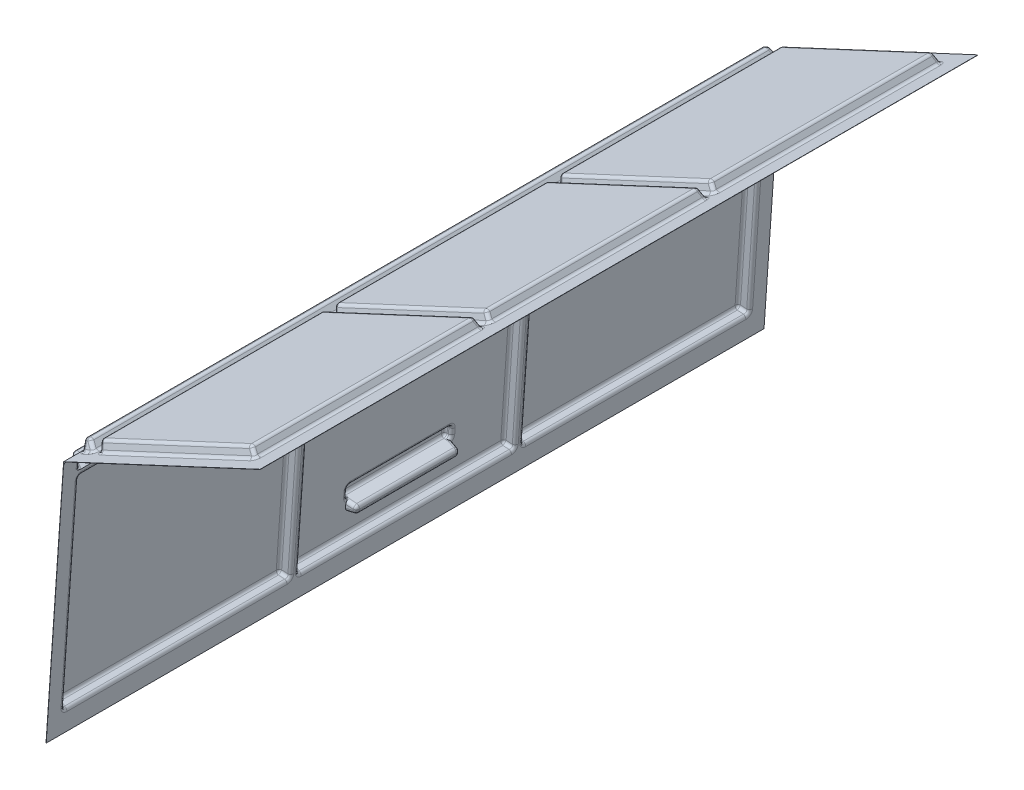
SolidWorks part; units mm, degrees
ref_plane "Plan de face" through (0, 0, 0) normal (0, 0, 1) x (1, 0, 0)
ref_plane "Plan de dessus" through (0, 0, 0) normal (0, 1, 0) x (1, 0, 0)
ref_plane "Plan de droite" through (0, 0, 0) normal (1, 0, 0) x (0, 0, -1)
sketch "Esquisse2" plane through (976.9196, -68.1059, 0) normal (-0.9976, 0.0695, 0) x (0, 0, 1)
  line L0 (-287.8758, 539.1032) -> (-287.8758, 154.1032) construction
  line L1 (-287.8758, 168.1032) -> (-1375.2758, 168.1032)
  line L2 (-287.8758, 168.1032) -> (-287.8758, 555.291)
  line L3 (-287.8758, 555.291) -> (-1375.2758, 555.291)
  line L4 (-1375.2758, 168.1032) -> (-1375.2758, 555.291)
  line L5 (-287.8758, 178.1032) -> (-1374.8758, 178.1032) construction
  line L6 (-291.0331, 555.291) -> (-304.0331, 555.291) construction
  line L7 (-1375.2758, 154.1032) -> (-1375.2758, 539.1032) construction
  dimension "D1" = 10
extrude "Boss.-Extru.1" add sketch "Esquisse2" along normal blind 0.25
sketch "Esquisse4" plane through (-3.1269, 6.702, 0) normal (-0.4228, 0.9062, 0) x (0.9062, 0.4228, 0)
  line L1 (1117.0576, 1375.2758) -> (1452.0576, 1375.2758)
  line L2 (1117.0576, 1375.2758) -> (1117.0576, 287.8758)
  line L3 (1117.0576, 287.8758) -> (1452.0576, 287.8758)
  line L4 (1452.0576, 1375.2758) -> (1452.0576, 287.8758)
  line L7 (1125.4987, 1375.2758) -> (937.7863, 1375.2758) construction
  line L8 (937.7863, 287.8758) -> (1125.4987, 287.8758) construction
  line L9 (1452.0576, 307.6182) -> (1452.0576, 1355.3333) construction
  dimension "D1" = 335
extrude "Boss.-Extru.2" add sketch "Esquisse4" along normal blind 0.25 separate body
sketch "Esquisse5" plane through (0, 0, -1375.2758) normal (0, 0, -1) x (-1, 0, 0)
  line L0 (-1015.2792, 482.1298) -> (-1015.5379, 485.8406)
  line L1 (-1015.5379, 485.8406) -> (-988.6105, 99.5903) construction
  line L2 (-1312.6491, 620.872) -> (-1009.0659, 479.2309) construction
  line L3 (-1015.5379, 485.8406) -> (-1015.2885, 485.858)
  line L4 (-1015.2885, 485.858) -> (-1009.0659, 479.2309)
  line L5 (-1009.0659, 479.2309) -> (-1009.1716, 479.0044)
  line L6 (-1312.7548, 620.6455) -> (-1009.1716, 479.0044) construction
  line L7 (-1009.1716, 479.0044) -> (-1015.0003, 481.7238)
  line L8 (-1015.2885, 485.858) -> (-988.3611, 99.6077) construction
  line L9 (-1015.0003, 481.7238) -> (-1015.0202, 482.009)
  line L10 (-1015.0202, 482.009) -> (-1015.2792, 482.1298)
extrude "Enlèv. mat.-Extru.1" cut sketch "Esquisse5" against normal through all
sketch "Esquisse6" plane through (976.6702, -68.0885, 0) normal (-0.9976, 0.0695, 0) x (0, 0, 1)
  line L0 (-1375.2758, 551.4327) -> (-287.8758, 168.1032) construction
  line L1 (-287.8758, 551.5712) -> (-1375.2758, 168.1032) construction
  line L2 (-831.5758, 359.7679) -> (-484.0758, 359.7679) construction
  line L3 (-996.5758, 519.7679) -> (-666.5758, 519.7679)
  line L4 (-996.5758, 519.7679) -> (-996.5758, 199.7679)
  line L5 (-996.5758, 199.7679) -> (-666.5758, 199.7679)
  line L6 (-666.5758, 519.7679) -> (-666.5758, 199.7679)
  line L7 (-996.5758, 519.7679) -> (-666.5758, 199.7679) construction
  line L8 (-996.5758, 199.7679) -> (-666.5758, 519.7679) construction
  line L9 (-831.5758, 359.7679) -> (-831.5758, 519.7679) construction
  line L10 (-656.5758, 519.7679) -> (-311.5758, 519.7679)
  line L11 (-656.5758, 519.7679) -> (-656.5758, 199.7679)
  line L12 (-656.5758, 199.7679) -> (-311.5758, 199.7679)
  line L13 (-311.5758, 519.7679) -> (-311.5758, 199.7679)
  line L14 (-656.5758, 519.7679) -> (-311.5758, 199.7679) construction
  line L15 (-656.5758, 199.7679) -> (-311.5758, 519.7679) construction
  line L16 (-1006.5758, 199.7679) -> (-1351.5758, 199.7679)
  line L17 (-1351.5758, 519.7679) -> (-1351.5758, 199.7679)
  line L18 (-1006.5758, 519.7679) -> (-1006.5758, 199.7679)
  line L19 (-1006.5758, 519.7679) -> (-1351.5758, 519.7679)
  point P8 (-831.5758, 359.7679)
  dimension "D1" = 330
  dimension "D2" = 320
  dimension "D3" = 345
  dimension "D4" = 10
  dimension "D5" = 320
extrude "Boss.-Extru.3" add sketch "Esquisse6" along normal blind 15 draft 15
sketch "Esquisse7" plane through (-3.2326, 6.9285, 0) normal (-0.4228, 0.9062, 0) x (0.9062, 0.4228, 0)
  line L0 (1452.0576, 1375.2758) -> (1123.914, 287.8758) construction
  line L1 (1123.914, 1375.2758) -> (1452.0576, 287.8758) construction
  line L2 (1287.9858, 831.5758) -> (1287.9858, 484.0758) construction
  line L3 (1417.9858, 996.5758) -> (1157.9858, 996.5758)
  line L4 (1417.9858, 996.5758) -> (1417.9858, 666.5758)
  line L5 (1417.9858, 666.5758) -> (1157.9858, 666.5758)
  line L6 (1157.9858, 996.5758) -> (1157.9858, 666.5758)
  line L7 (1417.9858, 996.5758) -> (1157.9858, 666.5758) construction
  line L8 (1417.9858, 666.5758) -> (1157.9858, 996.5758) construction
  line L9 (1287.9858, 831.5758) -> (1452.0576, 831.5758) construction
  line L10 (1417.9858, 656.5758) -> (1157.9858, 656.5758)
  line L11 (1417.9858, 656.5758) -> (1417.9858, 311.5758)
  line L12 (1417.9858, 311.5758) -> (1157.9858, 311.5758)
  line L13 (1157.9858, 656.5758) -> (1157.9858, 311.5758)
  line L14 (1417.9858, 656.5758) -> (1157.9858, 311.5758) construction
  line L15 (1417.9858, 311.5758) -> (1157.9858, 656.5758) construction
  line L16 (1452.0576, 287.8758) -> (1452.0576, 1375.2758) construction
  line L17 (1417.9858, 1006.5758) -> (1157.9858, 1006.5758)
  line L18 (1417.9858, 1351.5758) -> (1157.9858, 1351.5758)
  line L19 (1157.9858, 1006.5758) -> (1157.9858, 1351.5758)
  line L20 (1417.9858, 1006.5758) -> (1417.9858, 1351.5758)
  point P8 (1287.9858, 831.5758)
  dimension "D1" = 260
  dimension "D2" = 330
  dimension "D3" = 260
  dimension "D4" = 345
  dimension "D5" = 10
extrude "Boss.-Extru.4" add sketch "Esquisse7" along normal blind 15
sketch "Esquisse8" plane through (0, 0, -287.8758) normal (0, 0, 1) x (1, 0, 0)
  line L0 (1015.0202, 482.009) -> (1300.3649, 285.9856) construction
  line L1 (1015.0003, 481.7238) -> (1312.7548, 620.6455) construction
  line L2 (988.6105, 99.5903) -> (1015.2792, 482.1298) construction
  line L3 (1014.8497, 475.9685) -> (1015.2594, 481.8447)
  line L4 (1015.2594, 481.8447) -> (1020.5974, 484.3352)
  arc A0 (1020.5974, 484.3352) -> (1014.8497, 475.9685) centre (1024.8255, 475.273) ccw
  point P5 (1015.2594, 481.8447)
  dimension "D1" = 20
extrude "Boss.-Extru.5" add sketch "Esquisse8" against normal up to surface (1087.4 mm away)
sketch "Esquisse9" plane through (0, 0, -311.5758) normal (0, 0, 1) x (1, 0, 0)
  line L0 (1018.9692, 483.8514) -> (1012.6271, 497.4447)
  line L1 (1312.6491, 620.872) -> (1015.0202, 482.009) construction
  line L2 (1012.6271, 497.4447) -> (1030.7514, 505.9009)
  line L3 (1030.7514, 505.9009) -> (1037.0936, 492.3076)
  line L4 (1039.8136, 510.129) -> (1046.1558, 496.5357) construction
  line L5 (1037.0936, 492.3076) -> (1018.9692, 483.8514)
  line L7 (1015.0202, 482.009) -> (1016.583, 480.9354) construction
  line L8 (1013.3262, 457.7103) -> (1014.7171, 477.6619)
  line L9 (998.3625, 458.7535) -> (1013.3262, 457.7103)
  line L10 (1014.7171, 477.6619) -> (999.7535, 478.7051)
  line L11 (999.7535, 478.7051) -> (998.3625, 458.7535)
  arc A0 (1020.5974, 484.3352) -> (1014.8497, 475.9685) centre (1024.8255, 475.273) ccw construction
  dimension "D1" = 15
  dimension "D2" = 20
  dimension "D3" = 10
  dimension "D4" = 120.5
extrude "Boss.-Extru.6" add sketch "Esquisse9" against normal up to surface (1040 mm away)
sketch "Esquisse10" plane through (961.7065, -67.0453, 0) normal (-0.9976, 0.0695, 0) x (0, 0, 1)
  line L0 (-831.5758, 515.7487) -> (-831.5758, 199.7679) construction
  line L1 (-670.595, 515.7487) -> (-992.5565, 515.7487) construction
  line L2 (-996.5758, 199.7679) -> (-666.5758, 199.7679) construction
  line L3 (-992.5565, 203.7872) -> (-670.595, 203.7872) construction
  line L4 (-751.5758, 233.7872) -> (-911.5758, 233.7872)
  line L5 (-751.5758, 233.7872) -> (-751.5758, 248.7872)
  line L6 (-751.5758, 248.7872) -> (-911.5758, 248.7872)
  line L7 (-911.5758, 233.7872) -> (-911.5758, 248.7872)
  line L8 (-751.5758, 233.7872) -> (-911.5758, 248.7872) construction
  line L9 (-751.5758, 248.7872) -> (-911.5758, 233.7872) construction
  point P6 (-831.5758, 241.2872)
  dimension "D1" = 160
  dimension "D2" = 15
  dimension "D3" = 30
extrude "Enlèv. mat.-Extru.2" cut sketch "Esquisse10" against normal blind 14
sketch "Esquisse11" plane through (961.7065, -67.0453, 0) normal (-0.9976, 0.0695, 0) x (0, 0, 1)
  line L0 (-831.5758, 248.7872) -> (-831.5758, 258.7872) construction
  line L1 (-751.5758, 248.7872) -> (-911.5758, 248.7872) construction
  line L3 (-911.5758, 268.7872) -> (-751.5758, 268.7872)
  line L4 (-911.5758, 268.7872) -> (-911.5758, 248.7872)
  line L5 (-911.5758, 248.7872) -> (-751.5758, 248.7872)
  line L6 (-751.5758, 268.7872) -> (-751.5758, 248.7872)
  line L7 (-911.5758, 268.7872) -> (-751.5758, 248.7872) construction
  line L8 (-911.5758, 248.7872) -> (-751.5758, 268.7872) construction
  dimension "D1" = 10
extrude "Boss.-Extru.8" add sketch "Esquisse11" along normal blind 10
draft "Dépouille1" type of draft neutral plane draft angle 15 faces to draft 12 parameters "D1"=15
draft "Dépouille2" type of draft neutral plane draft angle 15 faces to draft 12 parameters "D1"=15
draft "Dépouille3" type of draft neutral plane draft angle 10 faces to draft 7 parameters "D1"=10
draft "Dépouille4" type of draft neutral plane draft angle 20 faces to draft 4 parameters "D1"=20
draft "Dépouille5" type of draft neutral plane draft angle 20 faces to draft 4 parameters "D1"=20
fillet "Congé26" radius 5 8 edges at (975.3504, 200.5593, -752.4574) (974.0821, 182.3667, -752.4574) (969.7284, 191.8107, -753.339) (970.3012, 200.0275, -831.5758) (969.1555, 183.5939, -831.5758) (974.0821, 182.3667, -910.6941) (975.3504, 200.5593, -910.6941) (969.7284, 191.8107, -909.8125)
fillet "Congé29" radius 5 5 edges at (992.1033, 167.6647, -831.5758) (992.4532, 172.684, -909.1072) (985.0344, 166.9203, -910.3415) (985.0344, 166.9203, -752.8101) (992.4532, 172.684, -754.0443)
fillet "Congé31" radius 5 12 edges at (992.3243, 177.8225, -756.0896) (989.5703, 178.625, -753.5417) (981.8315, 182.4479, -752.0562) (979.7041, 191.1153, -751.5758) (980.2999, 199.6612, -753.0091) (980.3996, 201.091, -831.5758) (980.2999, 199.6612, -910.1424) (979.7041, 191.1153, -911.5758) (981.8315, 182.4479, -911.0953) (990.2574, 178.3769, -909.2905) (992.3243, 177.8225, -907.0619) (992.8031, 177.7032, -831.5758)
fillet "Congé32" radius 5 36 edges at (986.727, 291.8515, -315.595) (997.5748, 447.4546, -484.0758) (975.8791, 136.2484, -484.0758) (986.727, 291.8515, -652.5565) (997.5748, 447.4546, -831.5758) (986.727, 291.8515, -670.595) (975.8791, 136.2484, -831.5758) (986.727, 291.8515, -992.5565) (986.727, 291.8515, -1010.595) (997.5748, 447.4546, -1179.0758) (975.8791, 136.2484, -1179.0758) (986.727, 291.8515, -1347.5565) (983.2212, 133.7221, -654.5662) (983.2212, 133.7221, -313.5854) (990.5633, 131.1957, -484.0758) (1012.818, 450.4209, -1179.0758) (1001.6907, 290.8083, -1006.5758) (1005.1964, 448.9378, -1008.5854) (1005.1964, 448.9378, -654.5662) (1012.818, 450.4209, -831.5758) (1005.1964, 448.9378, -668.5854) (1001.6907, 290.8083, -666.5758) (1001.6907, 290.8083, -311.5758) (1012.818, 450.4209, -484.0758) (1005.1964, 448.9378, -313.5854) (983.2212, 133.7221, -668.5854) (1001.6907, 290.8083, -656.5758) (983.2212, 133.7221, -1008.5854) (1001.6907, 290.8083, -996.5758) (983.2212, 133.7221, -994.5662) (990.5633, 131.1957, -831.5758) (1005.1964, 448.9378, -994.5662) (1005.1964, 448.9378, -1349.5662) (990.5633, 131.1957, -1179.0758) (1001.6907, 290.8083, -1351.5758) (983.2212, 133.7221, -1349.5662)
fillet "Congé33" radius 5 36 edges at (1046.1558, 496.5357, -1179.0758) (1043.4559, 511.8284, -1179.0758) (1046.1558, 496.5357, -831.5758) (1043.4559, 511.8284, -831.5758) (1044.8058, 504.1821, -313.5854) (1157.622, 565.0942, -315.595) (1276.7804, 612.4131, -313.5854) (1163.9642, 551.5009, -311.5758) (1044.8058, 504.1821, -1349.5662) (1163.9642, 551.5009, -1351.5758) (1157.622, 565.0942, -1347.5565) (1163.9642, 551.5009, -656.5758) (1157.622, 565.0942, -652.5565) (1163.9642, 551.5009, -996.5758) (1157.622, 565.0942, -992.5565) (1044.8058, 504.1821, -994.5662) (1276.7804, 612.4131, -1349.5662) (1163.9642, 551.5009, -1006.5758) (1157.622, 565.0942, -1010.595) (1044.8058, 504.1821, -1008.5854) (1276.7804, 612.4131, -994.5662) (1276.7804, 612.4131, -1008.5854) (1281.7726, 606.4662, -1179.0758) (1271.7882, 618.3601, -1179.0758) (1281.7726, 606.4662, -831.5758) (1271.7882, 618.3601, -831.5758) (1163.9642, 551.5009, -666.5758) (1157.622, 565.0942, -670.595) (1276.7804, 612.4131, -668.5854) (1276.7804, 612.4131, -654.5662) (1281.7726, 606.4662, -484.0758) (1271.7882, 618.3601, -484.0758) (1044.8058, 504.1821, -654.5662) (1044.8058, 504.1821, -668.5854) (1046.1558, 496.5357, -484.0758) (1043.4559, 511.8284, -484.0758)
fillet "Congé38" radius 5 3 edges at (1014.0217, 467.6861, -311.5758) (1014.0217, 467.6861, -1351.5758) (1014.7171, 477.6619, -831.5758)
fillet "Congé39" radius 5 24 edges at (1013.8591, 478.3564, -1352.2089) (1012.4471, 458.1015, -310.9426) (1012.4471, 458.1015, -1352.2089) (1013.8591, 478.3564, -310.9426) (1005.3628, 474.9774, -1348.2473) (999.058, 468.7293, -317.0353) (1004.4349, 461.6667, -314.9043) (998.7422, 464.1998, -831.5758) (1004.4349, 461.6667, -1348.2473) (999.058, 468.7293, -1346.1162) (999.3738, 473.2587, -831.5758) (1005.3628, 474.9774, -314.9043) (1021.6892, 501.6728, -317.0353) (1017.5746, 499.7531, -831.5758) (1018.2719, 491.8023, -314.3055) (1031.4487, 497.9501, -314.3055) (1031.4487, 497.9501, -1348.846) (1028.0314, 488.0795, -1351.5758) (1021.6892, 501.6728, -1346.1162) (1025.8039, 503.5926, -831.5758) (1037.0936, 492.3076, -831.5758) (1028.0314, 488.0795, -311.5758) (1018.9692, 483.8514, -831.5758) (1018.2719, 491.8023, -1348.846)
shell "Coque4" thickness 0.25
ref_plane "Plan1" through (0, 0, -831.5758) normal (0, 0, 1) x (1, 0, 0)
